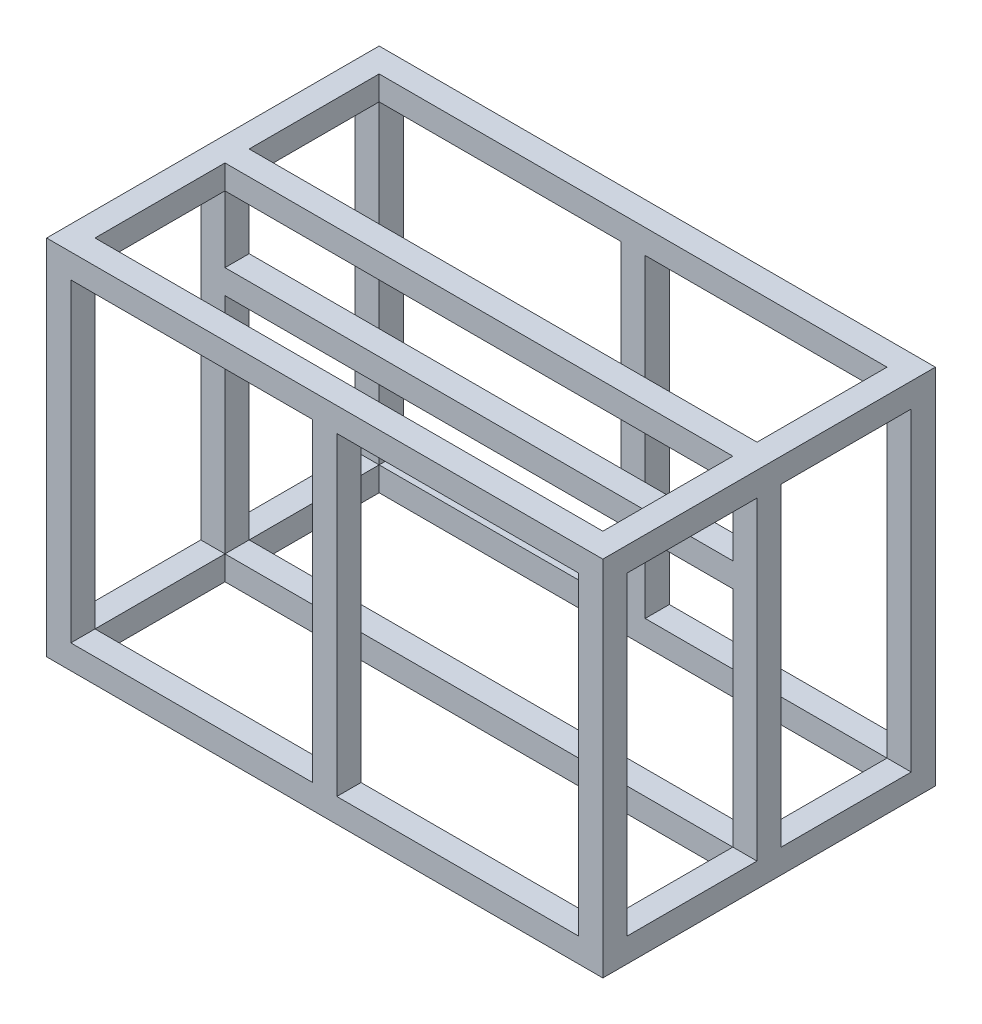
SolidWorks part; units mm, degrees
ref_plane "前视基准面" through (0, 0, 0) normal (0, 0, 1) x (1, 0, 0)
ref_plane "上视基准面" through (0, 0, 0) normal (0, 1, 0) x (1, 0, 0)
ref_plane "右视基准面" through (0, 0, 0) normal (1, 0, 0) x (0, 0, -1)
sketch "草图1" plane through (0, 0, 0) normal (0, 0, 1) x (1, 0, 0)
  line L0 (0, 0) -> (0, 600)
  line L1 (40, 40) -> (40, 410)
  line L2 (0, 600) -> (40, 600)
  line L3 (0, 0) -> (40, 0)
  line L4 (880, 40) -> (880, 410)
  line L5 (920, 0) -> (920, 600)
  line L6 (880, 600) -> (920, 600)
  line L7 (880, 0) -> (920, 0)
  line L8 (40, 560) -> (440, 560)
  line L9 (40, 600) -> (880, 600)
  line L10 (40, 0) -> (880, 0)
  line L11 (40, 40) -> (440, 40)
  line L12 (480, 40) -> (480, 410)
  line L13 (440, 40) -> (440, 410)
  line L14 (40, 410) -> (440, 410)
  line L15 (40, 450) -> (440, 450)
  line L16 (40, 450) -> (40, 560)
  line L17 (480, 560) -> (880, 560)
  line L18 (880, 450) -> (880, 560)
  line L19 (480, 450) -> (880, 450)
  line L20 (480, 410) -> (880, 410)
  line L21 (480, 450) -> (480, 560)
  line L22 (440, 450) -> (440, 560)
  line L23 (480, 40) -> (880, 40)
extrude "凸台-拉伸1" add sketch "草图1" along normal blind 550
sketch "草图2" plane through (0, 600, 0) normal (0, 1, 0) x (1, 0, 0)
  line L0 (0, -550) -> (40, -550)
  line L1 (0, -510) -> (0, -550)
  line L2 (40, 0) -> (0, 0)
  line L3 (0, 0) -> (0, -40)
  line L4 (920, -40) -> (920, 0)
  line L5 (920, 0) -> (880, 0)
  line L6 (880, -550) -> (920, -550)
  line L7 (920, -550) -> (920, -510)
  line L8 (880, -255) -> (880, -40)
  line L9 (40, -550) -> (880, -550)
  line L10 (40, -510) -> (880, -510)
  line L11 (40, -40) -> (880, -40)
  line L12 (40, 0) -> (880, 0)
  line L13 (920, -510) -> (920, -40)
  line L14 (880, -510) -> (880, -295)
  line L15 (40, -510) -> (40, -295)
  line L16 (0, -510) -> (0, -40)
  line L17 (40, -295) -> (880, -295)
  line L18 (40, -255) -> (880, -255)
  line L19 (40, -255) -> (40, -40)
extrude "切除-拉伸1" cut sketch "草图2" against normal through all flip side to cut
sketch "草图3" plane through (920, 0, 0) normal (1, 0, 0) x (0, 0, -1)
  line L0 (-510, 40) -> (-510, 560)
  line L1 (-40, 40) -> (-40, 560)
  line L2 (-510, 40) -> (-295, 40)
  line L3 (-510, 560) -> (-295, 560)
  line L4 (-255, 40) -> (-255, 560)
  line L5 (-295, 40) -> (-295, 560)
  line L6 (-255, 40) -> (-40, 40)
  line L7 (-255, 560) -> (-40, 560)
extrude "切除-拉伸2" cut sketch "草图3" against normal through all
sketch "草图4" plane through (0, 0, 550) normal (0, 0, 1) x (1, 0, 0)
  line L1 (40, 450) -> (440, 450)
  line L2 (40, 450) -> (40, 410)
  line L3 (40, 410) -> (440, 410)
  line L4 (440, 450) -> (440, 410)
  line L5 (480, 450) -> (880, 450)
  line L6 (480, 450) -> (480, 410)
  line L7 (480, 410) -> (880, 410)
  line L8 (880, 450) -> (880, 410)
extrude "切除-拉伸3" cut sketch "草图4" against normal up to next
sketch "草图5" plane through (0, 0, 0) normal (0, 0, -1) x (-1, 0, 0)
  line L1 (-880, 450) -> (-480, 450)
  line L2 (-880, 450) -> (-880, 410)
  line L3 (-880, 410) -> (-480, 410)
  line L4 (-480, 450) -> (-480, 410)
  line L5 (-440, 450) -> (-40, 450)
  line L6 (-440, 450) -> (-440, 410)
  line L7 (-440, 410) -> (-40, 410)
  line L8 (-40, 450) -> (-40, 410)
extrude "切除-拉伸4" cut sketch "草图5" against normal up to next
sketch "草图6" plane through (0, 0, 255) normal (0, 0, -1) x (-1, 0, 0)
  line L1 (-480, 410) -> (-440, 410)
  line L2 (-480, 410) -> (-480, 40)
  line L3 (-480, 40) -> (-440, 40)
  line L4 (-440, 410) -> (-440, 40)
extrude "切除-拉伸5" cut sketch "草图6" against normal up to next
sketch "草图7" plane through (0, 0, 255) normal (0, 0, -1) x (-1, 0, 0)
  line L1 (-480, 560) -> (-440, 560)
  line L2 (-480, 560) -> (-480, 450)
  line L3 (-480, 450) -> (-440, 450)
  line L4 (-440, 560) -> (-440, 450)
extrude "切除-拉伸6" cut sketch "草图7" against normal up to next
